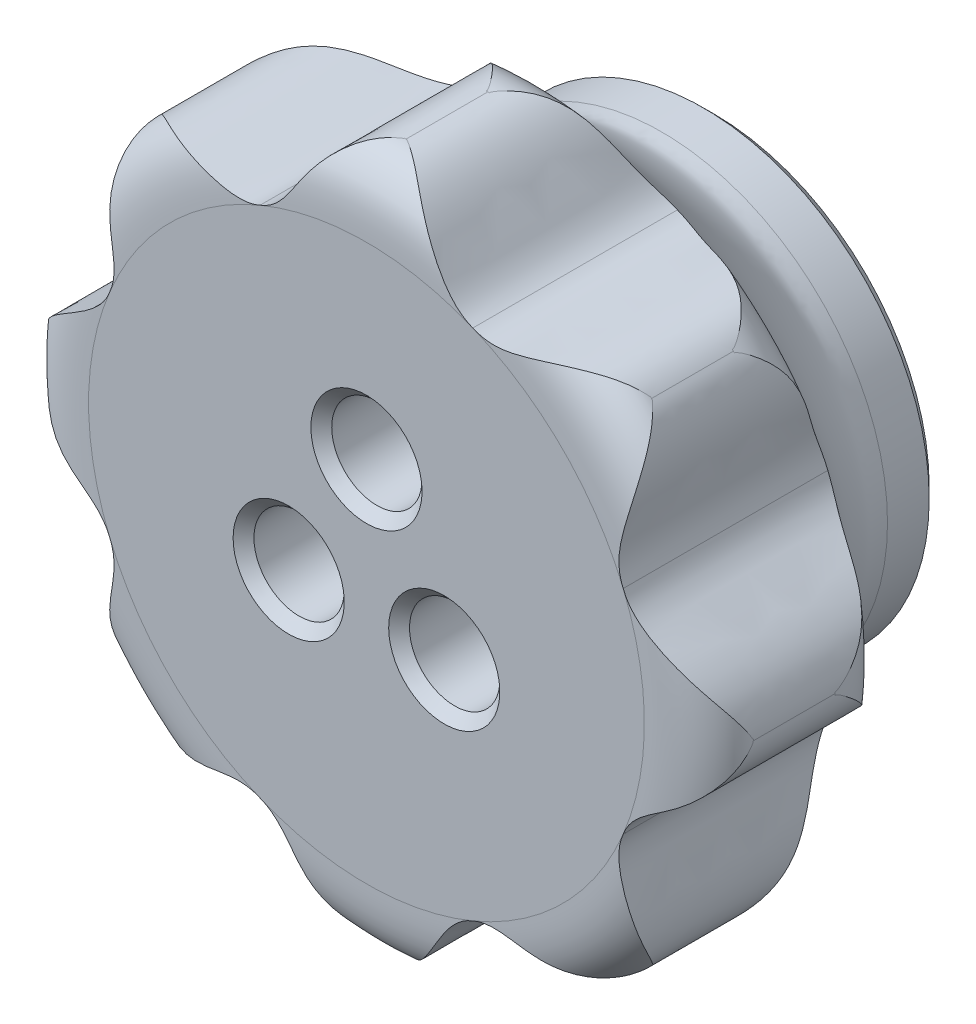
SolidWorks part; units mm, degrees
ref_plane "WL" through (0, 0, 0) normal (0, 0, 1) x (1, 0, 0)
ref_plane "BL" through (0, 0, 0) normal (0, 1, 0) x (1, 0, 0)
ref_plane "STA" through (0, 0, 0) normal (1, 0, 0) x (0, 0, -1)
sketch "Sketch3" plane through (0, 0, 0) normal (0, 1, 0) x (1, 0, 0)
  line L0 (0, 0) -> (0, -58.0502) construction
  line L1 (0, 0) -> (16.51, 0)
  line L2 (16.51, 0) -> (16.51, -3.81)
  line L3 (0, 0) -> (0, -25.4)
  line L4 (25.4, -22.5199) -> (25.4, -16.5289)
  line L5 (0, -25.4) -> (20.32, -25.4)
  line L6 (20.32, -25.4) -> (41.7512, -25.4) construction
  line L7 (25.4, -18.0028) -> (25.4, -22.5199) construction
  line L8 (20.32, -22.225) -> (32.9074, -22.225) construction
  spline S0 degree 3 poles (20.32, -25.4) (20.3747, -25.4) (21.4688, -25.4) (23.2643, -25.3332) (24.976, -23.9656) (25.4, -22.9331) (25.4, -22.5396) (25.4, -22.5199) knots 0 0 0 0 0.02501 0.500202 0.818758 0.990938 1 1 1 1
  spline S1 degree 3 poles (16.51, -3.81) (16.51, -3.8624) (16.51, -4.9099) (16.5455, -5.8846) (20.6051, -11.9988) (25.4, -12.9744) (25.4, -16.3596) (25.4, -16.5289) knots 0 0 0 0 0.006739 0.134782 0.552507 0.977625 1 1 1 1
  dimension "D1" = 16.51
  dimension "D2" = 25.4
  dimension "D3" = 20.32
  dimension "D4" = 3.81
  dimension "D5" = 25.4
  dimension "D6" = 3.175
revolve "Revolve1" add sketch "Sketch3" angle 360 about L0
sketch "Sketch4" plane through (0, 0, 0) normal (0, 0, -1) x (-1, 0, 0)
  line L0 (-5.6875, -3.2837) -> (0, 0) construction
  line L1 (0, 0) -> (5.6875, -3.2837) construction
  line L2 (0, 6.5674) -> (0, 0) construction
  circle A0 centre (0, 0) radius 6.5674 construction
  circle A1 centre (0, 6.5674) radius 2.375
  circle A2 centre (-5.6875, -3.2837) radius 2.375
  circle A3 centre (5.6875, -3.2837) radius 2.375
  dimension "D1" = 13.1347
  dimension "D4" = 4.75
  dimension "D2" = 120
  dimension "D3" = 120
extrude "Cut-Extrude1" cut sketch "Sketch4" against normal through all
sketch "Sketch5" plane through (0, 0, 0) normal (0, 0, -1) x (-1, 0, 0)
  circle A0 centre (0, 0) radius 2.667
  dimension "D1" = 5.334
extrude "Cut-Extrude2" cut sketch "Sketch5" against normal blind 5.08
sketch "Sketch6" plane through (0, 0, 25.4) normal (0, 0, 1) x (1, 0, 0)
  circle A0 centre (-5.6875, -3.2837) radius 2.375 construction
  circle A1 centre (5.6875, -3.2837) radius 2.375
  circle A2 centre (5.6875, -3.2837) radius 2.375 construction
  circle A3 centre (0, 6.5674) radius 2.375 construction
  circle A4 centre (-5.6875, -3.2837) radius 2.375 construction
  circle A5 centre (0, 6.5674) radius 2.375 construction
  circle A6 centre (0, 6.5674) radius 3.302
  circle A7 centre (5.6875, -3.2837) radius 3.302
  circle A8 centre (-5.6875, -3.2837) radius 3.302
  dimension "D2" = 6.604
  dimension "D1" = 0
extrude "Cut-Extrude3" cut sketch "Sketch6" against normal offset from surface (23.4 mm away) 2
sketch "Sketch7" plane through (0, 0, 0) normal (0, 0, 1) x (1, 0, 0)
  line L0 (0, 25.4) -> (0, 0) construction
  line L1 (7.7761, 18.7732) -> (0, 0) construction
  line L2 (4.4598, 22.4208) -> (0, 0) construction
  line L3 (0, 25.4) -> (4.404, 25.4) construction
  line L4 (7.7761, 18.7732) -> (8.6483, 18.412) construction
  line L5 (0, 25.4) -> (0, 27.3065)
  line L6 (17.9605, 17.9605) -> (20.5819, 20.1027)
  arc A2 (0, 27.3065) -> (20.5819, 20.1027) centre (-7.3473, -26.6898) cw
  circle A3 centre (0, 0) radius 22.86 construction
  circle A4 centre (0, 0) radius 20.32 construction
  spline S0 degree 3 poles (0, 25.4) (0.0913, 25.4) (1.9173, 25.4) (4.682, 22.665) (6.1736, 19.437) (7.6998, 18.8048) (7.7761, 18.7732) knots 0 0 0 0 0.026053 0.521061 0.976053 1 1 1 1
  spline S1 degree 3 poles (17.9605, 17.9605) (17.896, 18.0251) (16.6048, 19.3163) (12.7159, 19.3372) (9.3786, 18.1094) (7.8524, 18.7416) (7.7761, 18.7732) knots 0 0 0 0 0.026053 0.521061 0.976053 1 1 1 1
  point P50 (0, 0)
  point P65 (0, 0)
  dimension "D1" = 11.25
  dimension "D2" = 45.72
  dimension "D3" = 11.25
extrude "Cut-Extrude16" cut sketch "Sketch7" along normal through all
pattern_circular "CirPattern1" count 8 over 360 about axis through (0, 0, 5.08) along (0, 0, -1) of "Cut-Extrude16"
chamfer "Chamfer1" distance 0.762 angle 45 3 edges at (8.9895, -3.2837, 25.4) (-2.3855, -3.2837, 25.4) (3.302, 6.5674, 25.4)
chamfer "Chamfer2" distance 0.762 angle 45 1 edges at (-16.51, 0, 0)
